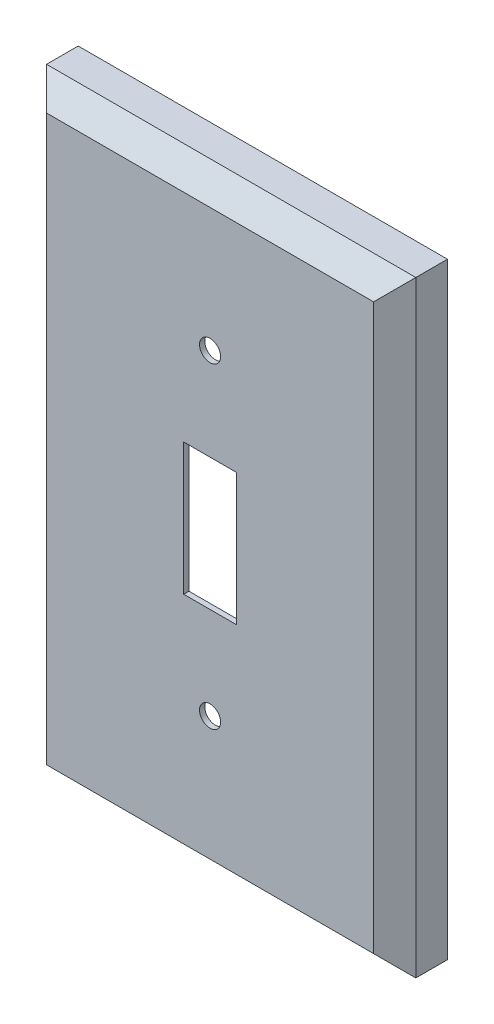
SolidWorks part; units mm, degrees
ref_plane "Plane1" through (0, 0, 0) normal (0, 0, 1) x (1, 0, 0)
ref_plane "Plane2" through (0, 0, 0) normal (0, 1, 0) x (1, 0, 0)
ref_plane "Plane3" through (0, 0, 0) normal (1, 0, 0) x (0, 0, -1)
sketch "Sketch1" plane through (0, 0, 0) normal (0, 0, 1) x (1, 0, 0)
  line L1 (0, 0) -> (70, 0)
  line L2 (0, 0) -> (0, 115)
  line L3 (0, 115) -> (70, 115)
  line L4 (70, 0) -> (70, 115)
  dimension "D1" = 70
  dimension "D2" = 115
extrude "Base-Extrude" add sketch "Sketch1" along normal blind 10
chamfer "Chamfer2" distance 4 angle 45 4 edges at (70, 57.5, 10) (35, 115, 10) (0, 57.5, 10) (35, 0, 10)
shell "Shell1" thickness 1
sketch "Sketch3" plane through (0, 0, 0) normal (0, 0, -1) x (-1, 0, 0)
  line L0 (-70, 0) -> (0, 0) construction
  line L1 (-30, 45) -> (-40, 45)
  line L2 (-30, 45) -> (-30, 70)
  line L3 (-30, 70) -> (-40, 70)
  line L4 (-40, 45) -> (-40, 70)
  line L5 (0, 0) -> (0, 115) construction
  dimension "D1" = 10
  dimension "D2" = 25
  dimension "D3" = 45
  dimension "D4" = 30
extrude "switchhole" cut sketch "Sketch3" against normal through all
sketch "Sketch4" plane through (0, 0, 0) normal (0, 0, -1) x (-1, 0, 0)
  line L0 (0, 0) -> (0, 115) construction
  line L1 (-70, 0) -> (0, 0) construction
  circle A0 centre (-35, 87.5) radius 2
  circle A1 centre (-35, 27.5) radius 2
  dimension "D1" = 4
  dimension "D2" = 60
  dimension "D3" = 35
  dimension "D4" = 27.5
extrude "screwhole" cut sketch "Sketch4" against normal through all
